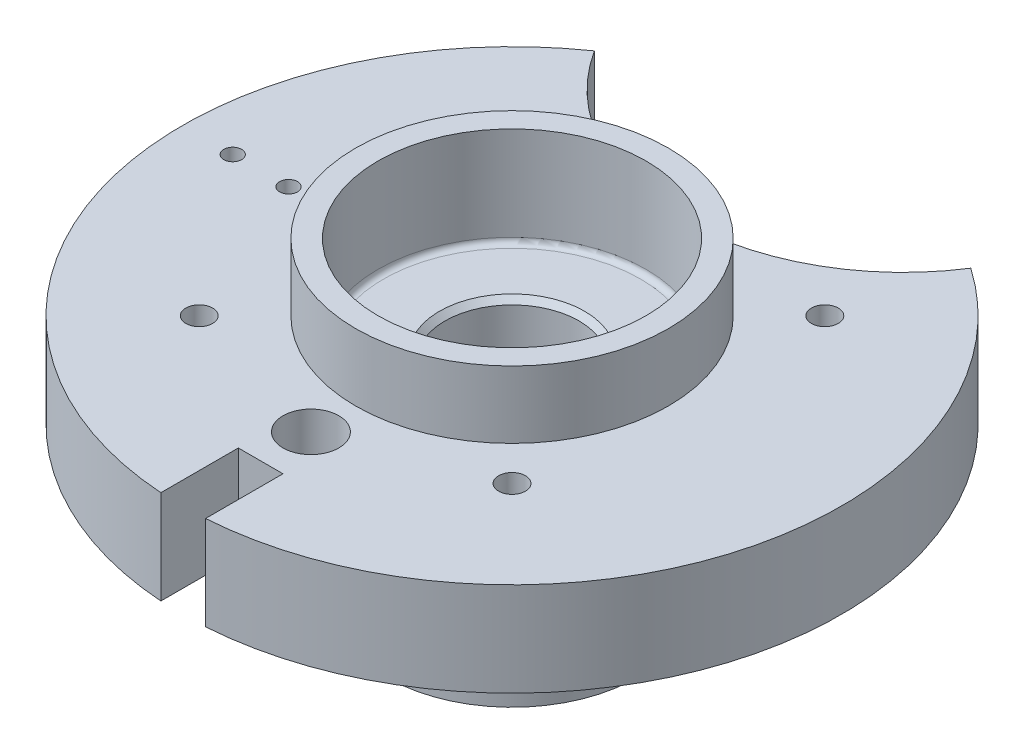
SolidWorks part; units mm, degrees
ref_plane "Plan1" through (0, 0, 0) normal (0, 0, 1) x (1, 0, 0)
ref_plane "Plan2" through (0, 0, 0) normal (0, 1, 0) x (1, 0, 0)
ref_plane "Plan3" through (0, 0, 0) normal (1, 0, 0) x (0, 0, -1)
sketch "Esquisse1" plane through (0, 0, 0) normal (0, 0, 1) x (1, 0, 0)
  line L0 (0, 0) -> (0, 114.126) construction
  line L1 (24, 56.8) -> (28, 56.8)
  line L2 (28, 56.8) -> (28, 44.8)
  line L3 (28, 44.8) -> (59, 44.8)
  line L4 (59, 44.8) -> (59, 28)
  line L5 (59, 28) -> (29, 28)
  line L6 (29, 28) -> (29, 18)
  line L7 (29, 18) -> (22.5, 18)
  line L8 (22.5, 18) -> (22.5, 0)
  line L9 (22.5, 0) -> (12, 0)
  line L10 (12, 0) -> (12, 39)
  line L11 (12, 39) -> (24, 39)
  line L12 (24, 39) -> (24, 56.8)
  dimension "D1" = 59
  dimension "D2" = 28
  dimension "D3" = 29
  dimension "D4" = 22.5
  dimension "D5" = 12
  dimension "D6" = 24
  dimension "D7" = 18
  dimension "D8" = 28
  dimension "D9" = 44.8
  dimension "D10" = 56.8
  dimension "D11" = 39
revolve "Base-Révolution" add sketch "Esquisse1" angle 360 about L0
sketch "Esquisse2" plane through (0, 44.8, 0) normal (0, 1, 0) x (-1, 0, 0)
  line L0 (0, 0) -> (0, -70.3626) construction
  circle A0 centre (0, -70) radius 40
  dimension "D1" = 40
  dimension "D2" = 70
extrude "Enlèv. mat.-Extru.1" cut sketch "Esquisse2" against normal up to next
other "Perçage1"
sketch "Esquisse4" plane through (0, 44.8, 0) normal (0, 1, 0) x (-1, 0, 0)
  circle A0 centre (26, -26) radius 2.4
  dimension "D1" = 4.8
  dimension "D2" = 26
  dimension "D3" = 26
other "Perçage2"
sketch "Esquisse5" plane through (0, 44.8, 0) normal (0, 1, 0) x (-1, 0, 0)
  circle A0 centre (-28, -28) radius 2.4
  dimension "D1" = 4.8
  dimension "D2" = 28
  dimension "D3" = 28
other "Perçage3"
sketch "Esquisse6" plane through (0, 44.8, 0) normal (0, 1, 0) x (-1, 0, 0)
  circle A0 centre (28, 28) radius 2.4
  dimension "D1" = 4.8
  dimension "D2" = 28
  dimension "D3" = 28
other "Perçage4"
sketch "Esquisse7" plane through (0, 44.8, 0) normal (0, 1, 0) x (-1, 0, 0)
  circle A0 centre (-26, 26) radius 2.4
  dimension "D1" = 4.8
  dimension "D2" = 26
  dimension "D3" = 26
other "Perçage5"
sketch "Esquisse8" plane through (0, 44.8, 0) normal (0, 1, 0) x (-1, 0, 0)
  circle A0 centre (40, 0) radius 1.6
  dimension "D1" = 3.2
  dimension "D2" = 40
other "Perçage6"
sketch "Esquisse9" plane through (0, 44.8, 0) normal (0, 1, 0) x (-1, 0, 0)
  circle A0 centre (50, 0) radius 1.6
  dimension "D1" = 3.2
  dimension "D2" = 50
fillet "Congé1" radius 1
chamfer "Chanfrein1" distance 1 angle 45
other "Perçage7"
sketch "Esquisse10" plane through (0, 44.8, 0) normal (0, 1, 0) x (-1, 0, 0)
  circle A0 centre (0, 36) radius 5
  arc A1 (33.6895, -48.4357) -> (-33.6895, -48.4357) centre (0, 0) ccw construction
  dimension "D1" = 10
  dimension "D2" = 36
sketch "Esquisse11" plane through (0, 44.8, 0) normal (0, 1, 0) x (-1, 0, 0)
  line L2 (-4, 58.8643) -> (-4, 45)
  line L3 (-4, 45) -> (4, 45)
  line L4 (4, 58.8643) -> (4, 45)
  arc A0 (33.6895, -48.4357) -> (-33.6895, -48.4357) centre (0, 0) ccw construction
  arc A1 (4, 58.8643) -> (-4, 58.8643) centre (0, 0) ccw
  dimension "D1" = 8
  dimension "D2" = 45
extrude "Enlèv. mat.-Extru.2" cut sketch "Esquisse11" against normal up to next
